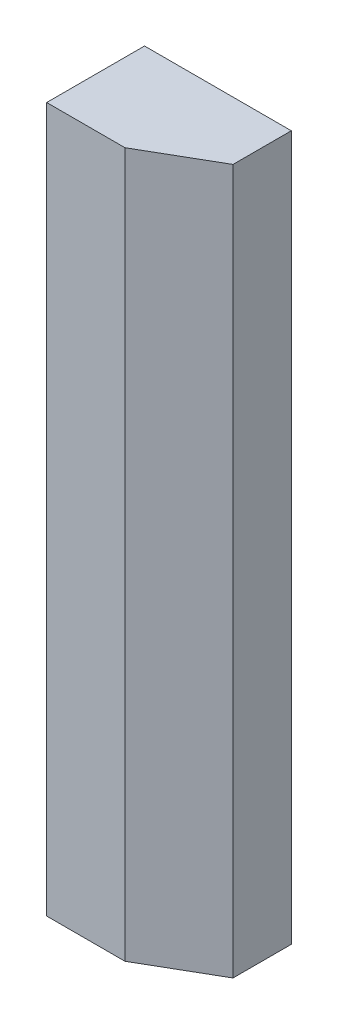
SolidWorks part; units mm, degrees
ref_plane "Plan de face" through (0, 0, 0) normal (0, 0, 1) x (1, 0, 0)
ref_plane "Plan de dessus" through (0, 0, 0) normal (0, 1, 0) x (1, 0, 0)
ref_plane "Plan de droite" through (0, 0, 0) normal (1, 0, 0) x (0, 0, -1)
sketch "Esquisse1" plane through (0, 0, 0) normal (0, 1, 0) x (1, 0, 0)
  line L0 (1, -10) -> (18.3205, 0)
  line L1 (-15, 10) -> (15, 10)
  line L2 (-15, 10) -> (-15, -10)
  line L3 (-15, -10) -> (15, -10)
  line L4 (15, 10) -> (15, -10)
  line L5 (-15, 10) -> (15, -10) construction
  line L6 (-15, -10) -> (15, 10) construction
  arc A0 (-19, -10) -> (18.3205, 0) centre (1, -10) cw
  point P0 (0, 0)
  point P5 (1, -10)
  point P10 (15, 4.2829)
  point P11 (15, -1.9171)
  dimension "D3" = 16
  dimension "D4" = 20
  dimension "D1" = 30
  dimension "D2" = 20
extrude "Boss.-Extru.1" add sketch "Esquisse1" along normal blind 144 contours L2 A0 L1 | L1 A0 L4 | A0 L2 L3 L0 L4
